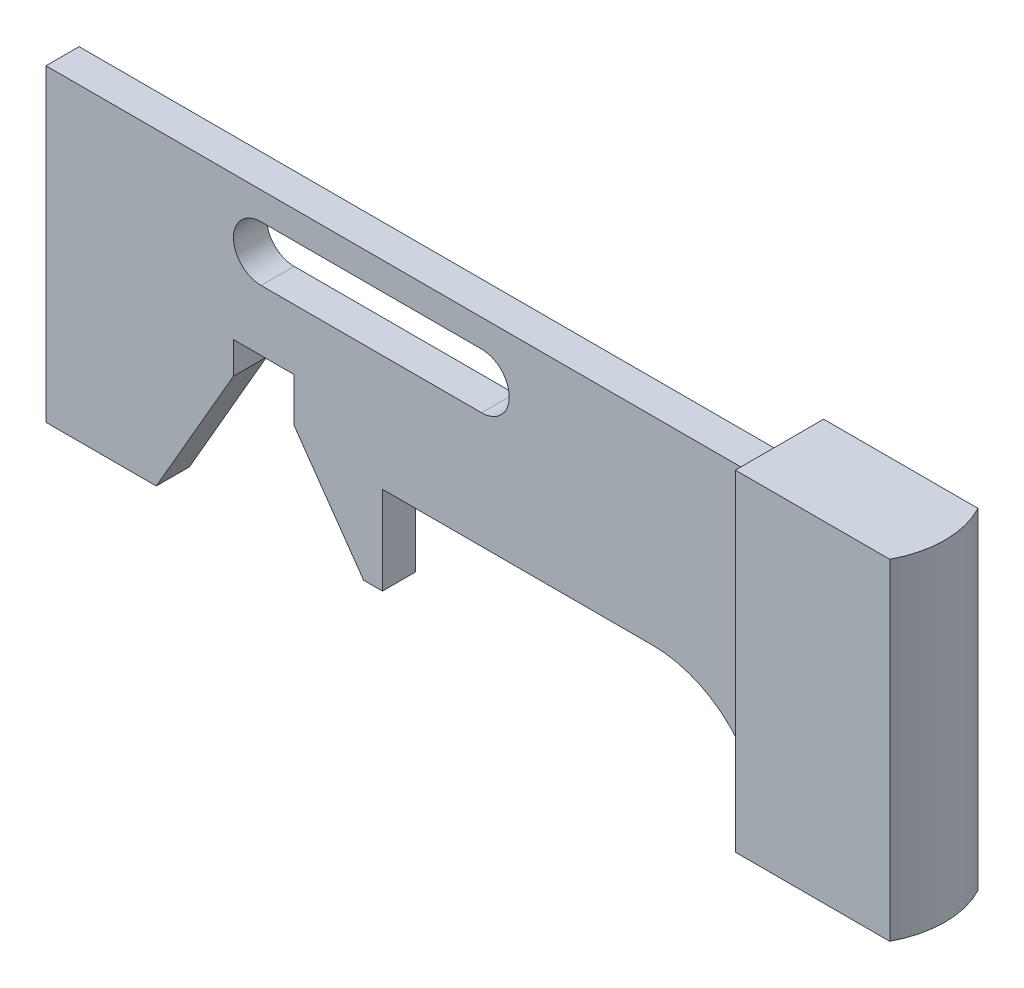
SolidWorks part; units mm, degrees
ref_plane "Ebene vorne" through (0, 0, 0) normal (0, 0, 1) x (1, 0, 0)
ref_plane "Ebene oben" through (0, 0, 0) normal (0, 1, 0) x (1, 0, 0)
ref_plane "Ebene rechts" through (0, 0, 0) normal (1, 0, 0) x (0, 0, -1)
sketch "Skizze2" plane through (0, 0, 0) normal (0, 1, 0) x (1, 0, 0)
  line L0 (0, -1.5) -> (65, -1.5)
  line L1 (65, -1.5) -> (65, -4)
  line L2 (65, -4) -> (79, -4)
  line L3 (0, -1.5) -> (0, 1.5)
  line L4 (0, 1.5) -> (65, 1.5)
  line L5 (65, 1.5) -> (65, 4)
  line L6 (65, 4) -> (79, 4)
  line L7 (-1.7563, 0) -> (71.3596, 0) construction
  arc A0 (79, 4) -> (79, -4) centre (71.5, 0) cw
  point P12 (80, 0)
  dimension "D3" = 1
  dimension "D4" = 8
  dimension "D1" = 65
  dimension "D2" = 80
  dimension "D5" = 3
extrude "Linear austragen1" add sketch "Skizze2" along normal blind 30
sketch "Skizze3" plane through (0, 0, 0) normal (0, 0, 1) x (1, 0, 0)
  line L0 (19.5, 23) -> (39.5, 23) construction
  line L1 (19.5, 25.5) -> (39.5, 25.5)
  line L2 (19.5, 20.5) -> (39.5, 20.5)
  line L3 (0, 30) -> (0, 0) construction
  line L4 (0, 30) -> (65, 30) construction
  arc A0 (19.5, 25.5) -> (19.5, 20.5) centre (19.5, 23) ccw
  arc A1 (39.5, 20.5) -> (39.5, 25.5) centre (39.5, 23) ccw
  point P2 (29.5, 23)
  dimension "D1" = 5
  dimension "D2" = 20
  dimension "D3" = 19.5
  dimension "D4" = 7
extrude "Langloch" cut sketch "Skizze3" against normal mid plane 3
sketch "Skizze4" plane through (0, 0, 0) normal (0, 0, 1) x (1, 0, 0)
  line L0 (65, 30) -> (65, 0) construction
  line L1 (0, 30) -> (65, 30)
  line L2 (0, 30) -> (0, 28)
  line L3 (0, 28) -> (65, 28)
  line L4 (65, 30) -> (65, 28)
  line L5 (10, 0) -> (17, 12.1244)
  line L6 (0, 0) -> (65, 0) construction
  line L7 (17, 12.1244) -> (17, 15)
  line L8 (17, 15) -> (22.5, 15)
  line L9 (22.5, 15) -> (22.5, 10.9973)
  line L10 (22.5, 10.9973) -> (28.8, 2)
  line L11 (28.8, 2) -> (30.5, 2)
  line L12 (30.5, 2) -> (30.5, 10)
  line L13 (30.5, 10) -> (55, 10)
  line L14 (10, 0) -> (65, 0)
  line L16 (0, 30) -> (0, 0) construction
  arc A0 (55, 10) -> (65, 0) centre (55, 0) cw
  dimension "D1" = 2
  dimension "D2" = 120
  dimension "D3" = 145
  dimension "D4" = 7
  dimension "D5" = 22.5
  dimension "D6" = 8
  dimension "D7" = 6.3
  dimension "D8" = 10
  dimension "D9" = 17
  dimension "D10" = 15
  dimension "D11" = 8
extrude "Aussparung für Schlüssel" cut sketch "Skizze4" against normal mid plane 3
